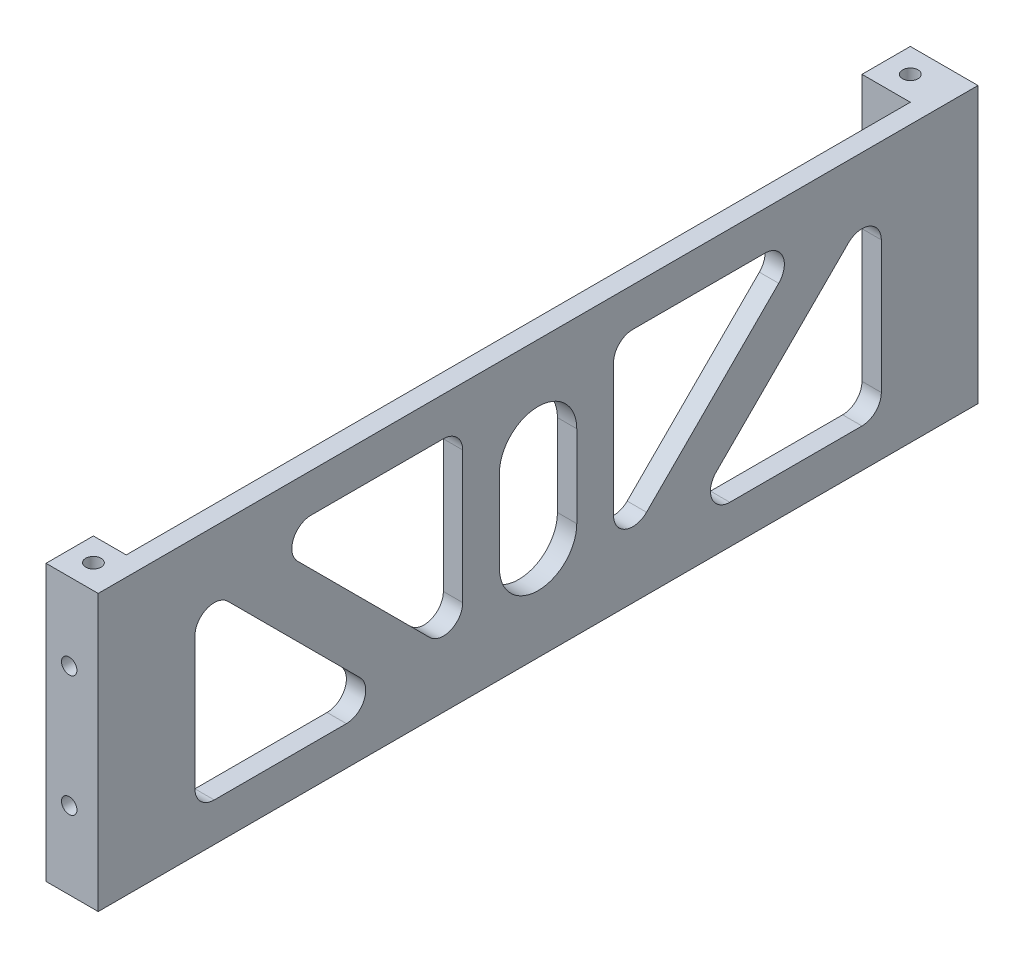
SolidWorks part; units mm, degrees
ref_plane "Front Plane" through (0, 0, 0) normal (0, 0, 1) x (1, 0, 0)
ref_plane "Top Plane" through (0, 0, 0) normal (0, 1, 0) x (1, 0, 0)
ref_plane "Right Plane" through (0, 0, 0) normal (1, 0, 0) x (0, 0, -1)
sketch "Sketch1" plane through (0, 0, 0) normal (1, 0, 0) x (0, 0, -1)
  line L1 (45.5, 14.25) -> (-45.5, 14.25)
  line L2 (45.5, 14.25) -> (45.5, -14.25)
  line L3 (45.5, -14.25) -> (-45.5, -14.25)
  line L4 (-45.5, 14.25) -> (-45.5, -14.25)
  line L5 (45.5, 14.25) -> (-45.5, -14.25) construction
  line L6 (45.5, -14.25) -> (-45.5, 14.25) construction
  point P0 (0, 0)
  dimension "D1" = 91
  dimension "D2" = 28.5
extrude "Boss-Extrude1" add sketch "Sketch1" along normal blind 2
sketch "Sketch2" plane through (0, 0, 0) normal (-1, 0, 0) x (0, 0, 1)
  line L0 (45.5, -14.25) -> (-45.5, -14.25) construction
  line L1 (-45.5, 14.25) -> (-40.5, 14.25)
  line L2 (-45.5, 14.25) -> (-45.5, -14.25)
  line L3 (-45.5, -14.25) -> (-40.5, -14.25)
  line L4 (-40.5, 14.25) -> (-40.5, -14.25)
  dimension "D1" = 5
extrude "Boss-Extrude2" add sketch "Sketch2" along normal blind 5
sketch "Sketch3" plane through (0, 0, 0) normal (-1, 0, 0) x (0, 0, 1)
  line L1 (45.5, -14.25) -> (40.6, -14.25)
  line L2 (45.5, -14.25) -> (-40.5, -14.25) construction
  line L4 (45.5, -14.25) -> (45.5, -11.25)
  line L6 (45.5, 14.25) -> (45.5, -14.25) construction
  line L8 (45.5, 14.25) -> (40.6, 14.25)
  line L9 (45.5, 14.25) -> (45.5, -11.25)
  line L11 (40.6, 14.25) -> (40.6, -14.25)
  dimension "D3" = 4.9
extrude "Boss-Extrude3" add sketch "Sketch3" along normal blind 3.4
hole_wizard "M2 Tapped Hole1" positions "Sketch11" profile "Sketch10" tap size "M2" standard "ISO"
sketch "Sketch11" plane through (0, -14.25, 0) normal (0, -1, 0) x (-1, 0, 0)
  line L0 (-2, -45.5) -> (-2, 45.5) construction
  line L1 (-2, 45.5) -> (5, 45.5) construction
  line L2 (-2, -45.5) -> (3.4, -45.5) construction
  point P0 (1, -43)
  point P2 (2.5, 43)
  dimension "D1" = 4.5
  dimension "D2" = 2.5
  dimension "D3" = 3
  dimension "D4" = 2.5
sketch "Sketch10" plane through (-1, -14.25, 43) normal (1, 0, 0) x (0, 0, -1)
  line L0 (0, 0) -> (0, 5.6807)
  line L1 (0, 5.6807) -> (0.8, 5.2)
  line L2 (0.8, 5.2) -> (0.8, 0)
  line L5 (0.8, 0) -> (0, 0)
  line L10 (0, 5.6807) -> (-0.8, 5.2) construction
  line L11 (0, -6.35) -> (0, 107.95) construction
  dimension "Tap Drill Dia." = 1.6
  dimension "Tap Drill Depth" = 5.2
  dimension "Drill Angle" = 118
mirror "Mirror1" about plane through (0, 0, 0) normal (0, 1, 0) of "M2 Tapped Hole1"
hole_wizard "M2 Tapped Hole3" positions "Sketch15" profile "Sketch14" tap size "M2" standard "ISO"
sketch "Sketch15" plane through (0, 0, -45.5) normal (0, 0, -1) x (-1, 0, 0)
  line L0 (-2, 14.25) -> (5, 14.25) construction
  line L1 (-2, -14.25) -> (-2, 14.25) construction
  line L2 (-2, -14.25) -> (5, -14.25) construction
  point P0 (1.5, 6.25)
  point P2 (1.5, -6.25)
  dimension "D1" = 8
  dimension "D2" = 3.5
  dimension "D3" = 8
  dimension "D4" = 3.5
sketch "Sketch14" plane through (-1.5, 6.25, -45.5) normal (1, 0, 0) x (0, 1, 0)
  line L0 (0, 0) -> (0, 5.6807)
  line L1 (0, 5.6807) -> (0.8, 5.2)
  line L2 (0.8, 5.2) -> (0.8, 0)
  line L5 (0.8, 0) -> (0, 0)
  line L10 (0, 5.6807) -> (-0.8, 5.2) construction
  line L11 (0, -6.35) -> (0, 107.95) construction
  dimension "Tap Drill Dia." = 1.6
  dimension "Tap Drill Depth" = 5.2
  dimension "Drill Angle" = 118
hole_wizard "M2 Tapped Hole4" positions "3DSketch1" profile "Sketch16" tap size "M2" standard "ISO"
sketch3d "3DSketch1"
  line L0 (2, 14.25, 45.5) -> (-3.4, 14.25, 45.5) construction
  line L1 (2, -14.25, 45.5) -> (-3.4, -14.25, 45.5) construction
  line L2 (2, 14.25, 45.5) -> (2, -14.25, 45.5) construction
  point P0 (-1, 6.25, 45.5)
  point P2 (-1, -6.25, 45.5)
  dimension "D1" = 8
  dimension "D2" = 8
  dimension "D3" = 3
  dimension "D4" = 3
sketch "Sketch16" plane through (-1, 6.25, 45.5) normal (1, 0, 0) x (0, -1, 0)
  line L0 (0, 0) -> (0, 5.6807)
  line L1 (0, 5.6807) -> (0.8, 5.2)
  line L2 (0.8, 5.2) -> (0.8, 0)
  line L5 (0.8, 0) -> (0, 0)
  line L10 (0, 5.6807) -> (-0.8, 5.2) construction
  line L11 (0, -6.35) -> (0, 107.95) construction
  dimension "Tap Drill Dia." = 1.6
  dimension "Tap Drill Depth" = 5.2
  dimension "Drill Angle" = 118
sketch "Sketch17" plane through (2, 0, 0) normal (1, 0, 0) x (0, 0, -1)
  line L0 (-35.5, 5.4216) -> (-35.5, -8.25)
  line L1 (-33.5, -10.25) -> (-19.8284, -10.25)
  line L2 (-18.4142, -6.8358) -> (-32.0858, 6.8358)
  line L3 (-24.8858, 6.8358) -> (-11.2142, -6.8358)
  line L4 (-7.8, -5.4216) -> (-7.8, 8.25)
  line L5 (-9.8, 10.25) -> (-23.4716, 10.25)
  line L6 (-45.5, 14.25) -> (-45.5, -14.25) construction
  line L7 (-45.5, -14.25) -> (45.5, -14.25) construction
  line L8 (45.5, 14.25) -> (-45.5, 14.25) construction
  arc A0 (-24.8858, 6.8358) -> (-23.4716, 10.25) centre (-23.4716, 8.25) cw
  arc A1 (-7.8, 8.25) -> (-9.8, 10.25) centre (-9.8, 8.25) ccw
  arc A2 (-11.2142, -6.8358) -> (-7.8, -5.4216) centre (-9.8, -5.4216) ccw
  arc A3 (-19.8284, -10.25) -> (-18.4142, -6.8358) centre (-19.8284, -8.25) ccw
  arc A4 (-33.5, -10.25) -> (-35.5, -8.25) centre (-33.5, -8.25) cw
  arc A5 (-35.5, 5.4216) -> (-32.0858, 6.8358) centre (-33.5, 5.4216) cw
  point P2 (-28.3, 10.25)
  point P9 (-7.8, -10.25)
  point P26 (-35.5, 10.25)
  dimension "D2" = 4
  dimension "D8" = 2
  dimension "D1" = 45
  dimension "D3" = 10
  dimension "D4" = 4
  dimension "D5" = 4
  dimension "D6" = 4
  dimension "D7" = 7.2
extrude "Cut-Extrude1" cut sketch "Sketch17" against normal through all
mirror "Mirror2" about plane through (0, 0, 0) normal (0, 0, 1) of "Cut-Extrude1"
sketch "Sketch18" plane through (2, 0, 0) normal (1, 0, 0) x (0, 0, -1)
  line L0 (0, 4.25) -> (0, -4.25) construction
  line L1 (4, 4.25) -> (4, -4.25)
  line L2 (-4, 4.25) -> (-4, -4.25)
  line L3 (45.5, 14.25) -> (-45.5, 14.25) construction
  line L4 (-45.5, -14.25) -> (45.5, -14.25) construction
  arc A0 (4, 4.25) -> (-4, 4.25) centre (0, 4.25) ccw
  arc A1 (-4, -4.25) -> (4, -4.25) centre (0, -4.25) ccw
  point P3 (0, 0)
  dimension "D1" = 4
  dimension "D2" = 10
  dimension "D3" = 10
extrude "Cut-Extrude2" cut sketch "Sketch18" against normal blind 10
